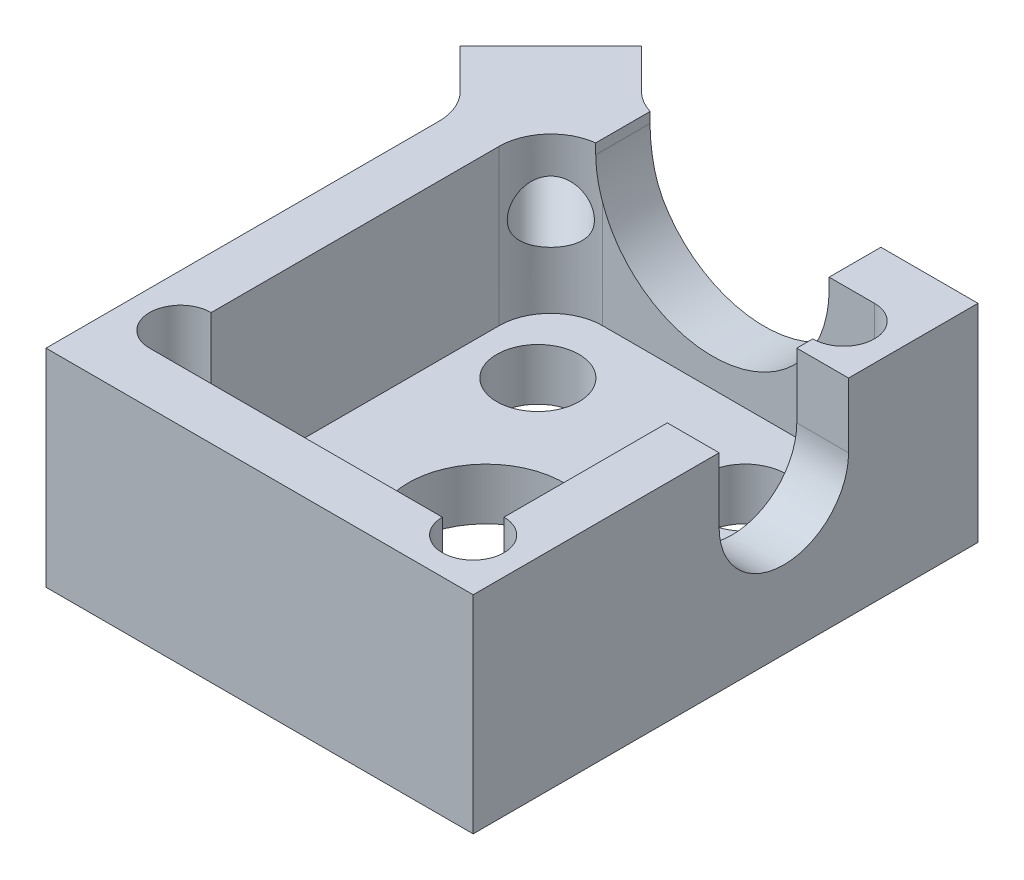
SolidWorks part; units mm, degrees
ref_plane "Front Plane" through (0, 0, 0) normal (0, 0, 1) x (1, 0, 0)
ref_plane "Top Plane" through (0, 0, 0) normal (0, 1, 0) x (1, 0, 0)
ref_plane "Right Plane" through (0, 0, 0) normal (1, 0, 0) x (0, 0, -1)
sketch "Sketch1" plane through (0, 0, 0) normal (0, 1, 0) x (1, 0, 0)
  line L7 (4.125, 4.875) -> (-4.125, 4.875)
  line L8 (4.125, 4.875) -> (4.125, -4.875)
  line L9 (4.125, -4.875) -> (-4.125, -4.875)
  line L10 (-4.125, 4.875) -> (-4.125, -4.875)
  line L11 (4.125, 4.875) -> (-4.125, -4.875) construction
  line L12 (4.125, -4.875) -> (-4.125, 4.875) construction
  point P0 (0, 0)
  point P6 (0, 0)
  dimension "D1" = 8.25
  dimension "D2" = 9.75
extrude "Boss-Extrude1" add sketch "Sketch1" along normal blind 4
sketch "Sketch2" plane through (0, 4, 0) normal (0, 1, 0) x (1, 0, 0)
  line L0 (-4.125, 4.875) -> (-4.125, -4.875) construction
  line L1 (3.125, 3.875) -> (-3.125, 3.875)
  line L2 (3.125, 3.875) -> (3.125, -3.875)
  line L3 (3.125, -3.875) -> (-3.125, -3.875)
  line L4 (-3.125, 3.875) -> (-3.125, -3.875)
  line L5 (3.125, 3.875) -> (-3.125, -3.875) construction
  line L6 (3.125, -3.875) -> (-3.125, 3.875) construction
  line L7 (4.125, 4.875) -> (-4.125, 4.875) construction
  point P0 (0, 0)
  dimension "D1" = 1
  dimension "D2" = 1
extrude "Cut-Extrude1" cut sketch "Sketch2" against normal offset from surface (3 mm away) 1
sketch "Sketch3" plane through (0, 1, 0) normal (0, 1, 0) x (1, 0, 0)
  line L0 (-3.125, -3.875) -> (3.125, -3.875) construction
  line L1 (3.125, -3.875) -> (3.125, 3.875) construction
  circle A0 centre (0.125, -0.625) radius 1.5
  dimension "D1" = 3
  dimension "D2" = 3.25
  dimension "D3" = 3
extrude "Cut-Extrude2" cut sketch "Sketch3" against normal through all
sketch "Sketch6" plane through (0, 4, 0) normal (0, 1, 0) x (1, 0, 0)
  line L0 (3.125, -3.875) -> (3.125, 3.875) construction
  line L1 (-3.125, 3.875) -> (-3.125, -3.875) construction
  line L2 (-3.125, -3.875) -> (3.125, -3.875) construction
  circle A0 centre (-3.125, -3.2797) radius 0.5953
  circle A1 centre (3.125, 3.2797) radius 0.5953
  circle A3 centre (3.125, -3.875) radius 0.5953
  dimension "D1" = 1.1906
extrude "Cut-Extrude5" cut sketch "Sketch6" against normal up to surface (3 mm away)
sketch "Sketch7" plane through (0, 1, 0) normal (0, 1, 0) x (1, 0, 0)
  line L0 (2.125, 2.375) -> (-1.875, 2.375) construction
  line L1 (-1.875, 2.375) -> (-1.875, -2.625) construction
  line L2 (-1.875, -2.625) -> (2.125, -2.625) construction
  line L3 (2.125, -2.625) -> (2.125, 2.375) construction
  line L4 (0.125, 2.375) -> (0.125, -0.625) construction
  circle A0 centre (2.125, 2.375) radius 0.7938
  circle A1 centre (-1.875, 2.375) radius 0.7937
  circle A2 centre (-1.875, -2.625) radius 0.7938
  circle A3 centre (2.125, -2.625) radius 0.7938
  circle A4 centre (0.125, -0.625) radius 1.5 construction
  dimension "D1" = 1.5875
  dimension "D2" = 4
  dimension "D3" = 3
  dimension "D4" = 2
extrude "Cut-Extrude6" cut sketch "Sketch7" against normal through all
sketch "Sketch8" plane through (4.125, 0, 0) normal (1, 0, 0) x (0, 0, -1)
  line L0 (-0.125, 2.75) -> (-0.125, 4)
  line L1 (-4.875, 4) -> (4.875, 4) construction
  line L2 (-0.125, 4) -> (2.375, 4)
  line L3 (2.375, 4) -> (2.375, 2.75)
  line L4 (4.875, 4) -> (4.875, 0) construction
  arc A0 (-0.125, 2.75) -> (2.375, 2.75) centre (1.125, 2.75) ccw
  dimension "D1" = 3.75
  dimension "D3" = 1.25
  dimension "D2" = 1.25
extrude "Cut-Extrude7" cut sketch "Sketch8" against normal up to surface (1 mm away)
sketch "Sketch9" plane through (0, 4, 0) normal (0, 1, 0) x (1, 0, 0)
  line L0 (-3.4268, 5.9268) -> (-5.1768, 4.1768)
  line L1 (-5.1768, 4.1768) -> (-4.125, 3.125)
  line L2 (-4.125, 3.125) -> (-2.375, 4.875)
  line L3 (-2.375, 4.875) -> (-3.4268, 5.9268)
  line L6 (4.125, 4.875) -> (-4.125, 4.875) construction
  line L7 (-4.125, 4.875) -> (-4.125, -4.875) construction
  dimension "D1" = 0.25
  dimension "D2" = 1.75
  dimension "D3" = 45
extrude "Boss-Extrude2" add sketch "Sketch9" against normal up to surface (4 mm away)
sketch "Sketch10" plane through (-4.6768, 0, -4.6768) normal (-0.7071, 0, -0.7071) x (-0.7071, 0, 0.7071)
  line L0 (-0.5303, 1.4) -> (-0.5303, 2.7) construction
  line L2 (-0.5303, 2.7) -> (-0.5303, 4) construction
  line L3 (-1.7678, 4) -> (0.7071, 4) construction
  line L4 (-0.5303, 1.4) -> (-0.5303, 0) construction
  line L5 (-1.7678, 0) -> (0.7071, 0) construction
  dimension "D1" = 1.3
hole_wizard "Tap Drill for #0-80 Tap1" positions "Sketch12" profile "Sketch11" hole size "#0-80" standard "ANSI Inch"
sketch "Sketch12" plane through (-4.6768, 0, -4.6768) normal (-0.7071, 0, -0.7071) x (-0.7071, 0, 0.7071)
  point P0 (-0.5303, 2.7)
sketch "Sketch11" plane through (-4.3018, 2.7, -5.0518) normal (0, 1, 0) x (-0.7071, 0, 0.7071)
  line L0 (0, 0) -> (0, 7.4679)
  line L1 (0, 7.4679) -> (0.5956, 7.11)
  line L2 (0.5956, 7.11) -> (0.5956, 0)
  line L5 (0.5956, 0) -> (0, 0)
  line L10 (0, 7.4679) -> (-0.5956, 7.11) construction
  line L11 (0, -6.35) -> (0, 107.95) construction
  dimension "Hole Dia." = 1.1913
  dimension "Hole Depth" = 7.11
  dimension "Drill Angle" = 118
fillet "Fillet3" radius 1 4 edges at (-2.375, 2, -4.875) (-4.125, 2, -3.125) (-3.125, 1.5522, -3.875) (-3.125, 3.6478, -3.875)
sketch "Sketch5" plane through (0, 0, -4.875) normal (0, 0, -1) x (-1, 0, 0)
  line L0 (-2.25, 3.8) -> (-2.25, 10.3491)
  line L1 (-4.125, 0) -> (1.9608, 0) construction
  line L2 (0, 3.8) -> (0, 0) construction
  line L5 (-2.25, 10.3491) -> (2.25, 10.3491)
  line L6 (2.25, 10.3491) -> (2.25, 3.8)
  arc A0 (-2.25, 3.8) -> (2.25, 3.8) centre (0, 3.8) ccw
  dimension "D1" = 2.25
  dimension "D2" = 3.8
extrude "Cut-Extrude4" cut sketch "Sketch5" against normal up to next and the other way through all
